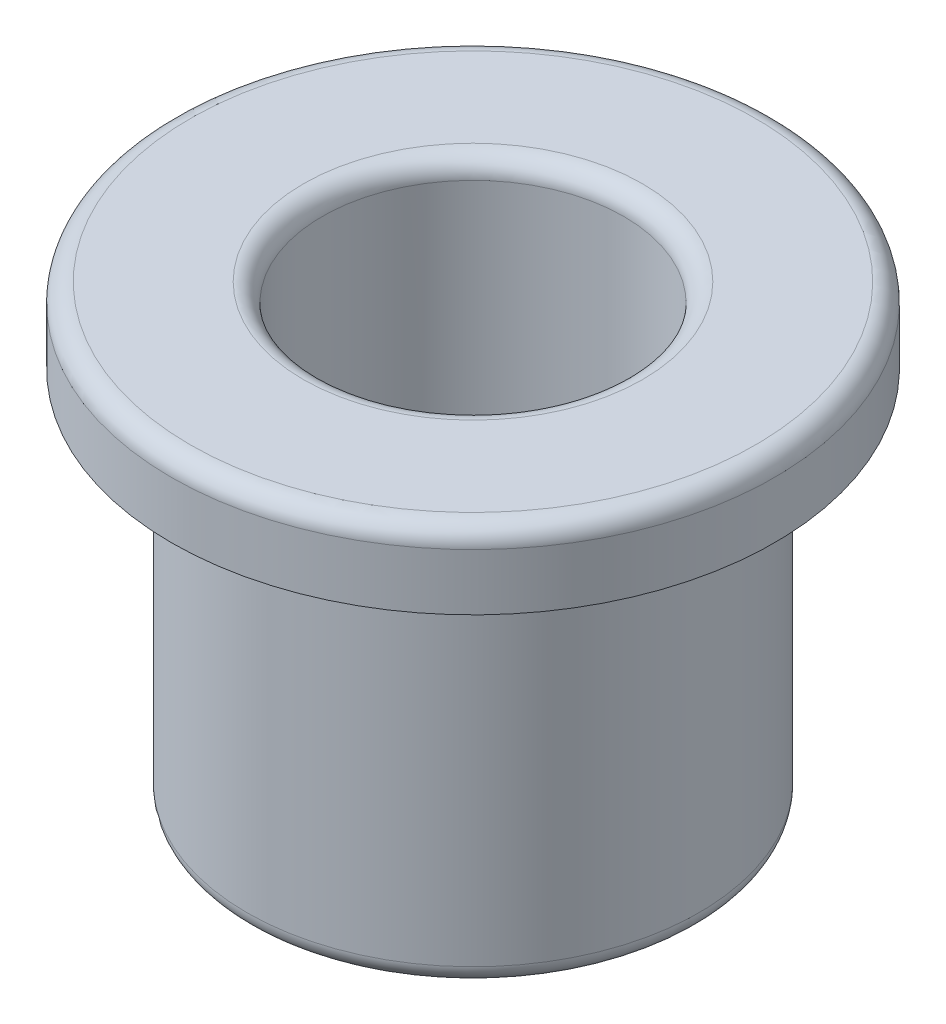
SolidWorks part; units mm, degrees
ref_plane "Face" through (0, 0, 0) normal (0, 0, 1) x (1, 0, 0)
ref_plane "Dessus" through (0, 0, 0) normal (0, 1, 0) x (1, 0, 0)
ref_plane "Droite" through (0, 0, 0) normal (1, 0, 0) x (0, 0, -1)
sketch "Esquisse1" plane through (0, 0, 0) normal (0, 0, 1) x (1, 0, 0)
  line L0 (0, 0) -> (0, 16.9468) construction
  line L1 (4, 0) -> (6, 0)
  line L2 (4, 0) -> (4, 12)
  line L4 (6, 0) -> (6, 10)
  line L5 (6, 10) -> (8, 10)
  line L7 (4, 12) -> (8, 12)
  line L8 (8, 10) -> (8, 12)
  dimension "D1" = 4
  dimension "D2" = 6
  dimension "D3" = 12
  dimension "D4" = 8
  dimension "D5" = 2
revolve "Révolution1" add sketch "Esquisse1" angle 360 about L0
fillet "Congé1" radius 0.5 5 edges at (0, 0, -4) (0, 0, -6) (0, 10, -6) (0, 12, -8) (0, 12, -4)
